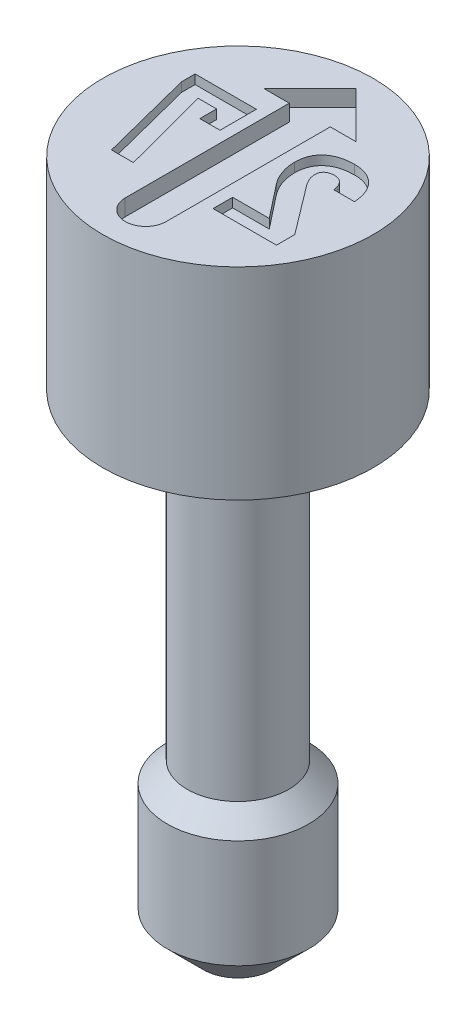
SolidWorks part; units mm, degrees
ref_plane "Front Plane" through (0, 0, 0) normal (0, 0, 1) x (1, 0, 0)
ref_plane "Top Plane" through (0, 0, 0) normal (0, 1, 0) x (1, 0, 0)
ref_plane "Right Plane" through (0, 0, 0) normal (1, 0, 0) x (0, 0, -1)
sketch "Sketch1" plane through (0, 0, 0) normal (0, 0, 1) x (1, 0, 0)
  line L0 (0, 17.018) -> (3.3528, 17.018)
  line L1 (0, -3.6881) -> (0, 3.6881) construction
  line L2 (3.3528, 17.018) -> (3.3528, 12.0142)
  line L3 (3.3528, 12.0142) -> (1.2573, 12.0142)
  line L4 (1.2573, 12.0142) -> (1.2573, 4.064)
  line L5 (1.2573, 4.064) -> (1.7526, 3.5687)
  line L6 (1.7526, 3.5687) -> (1.7526, 0.889)
  line L7 (1.7526, 0.889) -> (0.8636, 0)
  line L8 (3.6881, 0) -> (-3.6881, 0) construction
  line L9 (0.8636, 0) -> (0, 0)
  line L10 (0, 0) -> (0, 17.018)
  line L11 (0, 0) -> (0, 64.9194) construction
  dimension "D1" = 17.018
  dimension "D2" = 4.064
  dimension "D3" = 0.889
  dimension "D4" = 45
  dimension "D5" = 3.5052
  dimension "D6" = 6.7056
  dimension "D7" = 2.5146
  dimension "D8" = 5.0038
revolve "Revolve1" add sketch "Sketch1" angle 360 about L11
sketch "Sketch2" plane through (0, 17.018, 0) normal (0, 1, 0) x (1, 0, 0)
  line L1 (0.508, -2.286) -> (0.508, 1.778)
  line L2 (-0.508, -2.286) -> (-0.508, 1.778)
  line L3 (0, -3.6881) -> (0, 3.6881) construction
  line L4 (-0.508, 1.778) -> (-1.143, 1.778)
  line L5 (0.508, 1.778) -> (1.143, 1.778)
  line L6 (1.143, 1.778) -> (0, 2.921)
  line L7 (0, 2.921) -> (-1.143, 1.778)
  line L8 (-3.6881, 0) -> (3.6881, 0) construction
  arc A0 (-0.508, -2.286) -> (0.508, -2.286) centre (0, -2.286) ccw
  dimension "D6" = 2.286
  dimension "D1" = 1.016
  dimension "D2" = 0.508
  dimension "D3" = 2.286
  dimension "D4" = 1.143
  dimension "D5" = 45
  dimension "D7" = 1.778
extrude "Cut-Extrude1" cut sketch "Sketch2" against normal blind 0.4064
sketch "Sketch3" plane through (0, 17.018, 0) normal (0, 1, 0) x (1, 0, 0)
  text T0 "2 7" font "Bahnschrift" height 2.667
extrude "Cut-Extrude2" cut sketch "Sketch3" against normal blind 0.2286
